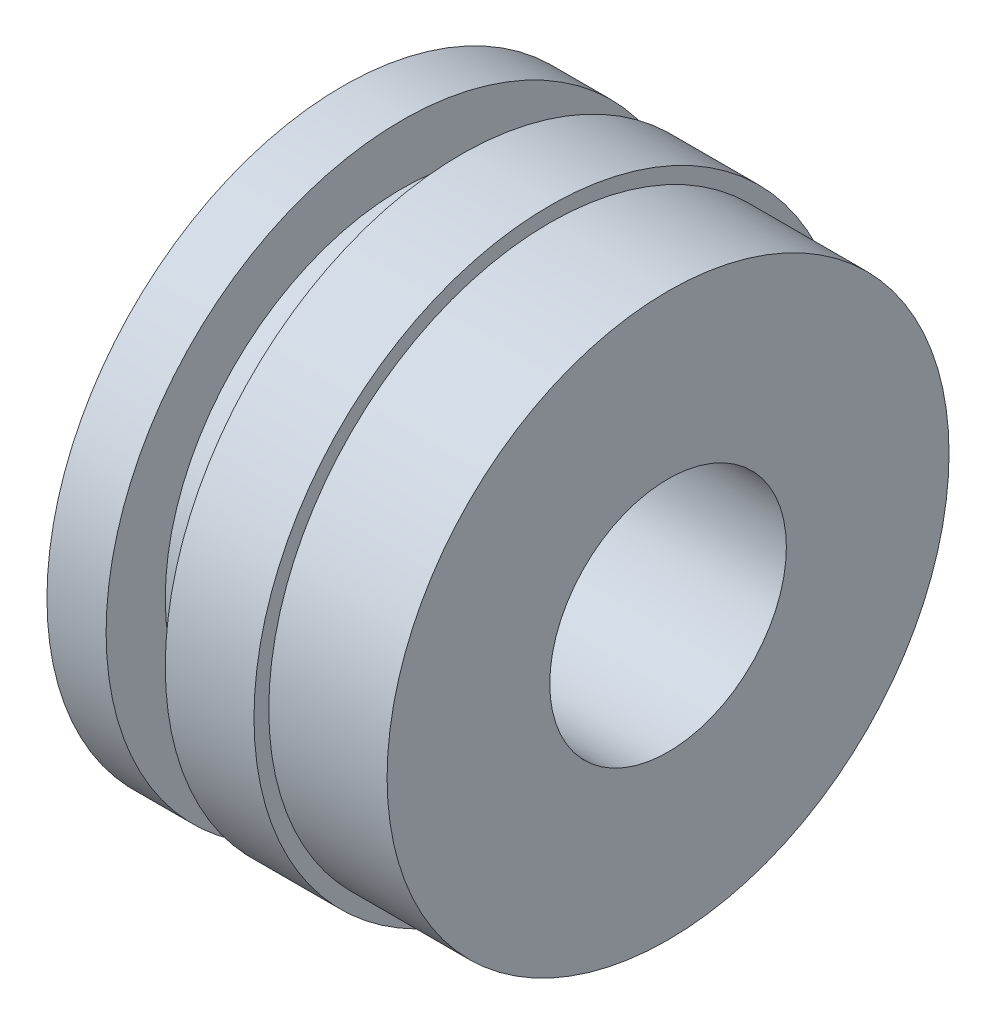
SolidWorks part; units mm, degrees
ref_plane "Plan1" through (0, 0, 0) normal (0, 0, 1) x (1, 0, 0)
ref_plane "Plan2" through (0, 0, 0) normal (0, 1, 0) x (1, 0, 0)
ref_plane "Plan3" through (0, 0, 0) normal (1, 0, 0) x (0, 0, -1)
sketch "Esquisse1" plane through (0, 0, 0) normal (0, 0, 1) x (1, 0, 0)
  line L0 (-25, 0) -> (44, 0) construction
  line L1 (0, 4) -> (11, 4)
  line L2 (0, 4) -> (0, 10)
  line L3 (0, 10) -> (2, 10)
  line L4 (2, 10) -> (2, 8)
  line L5 (2, 8) -> (4, 8)
  line L6 (4, 8) -> (4, 10)
  line L7 (4, 10) -> (7, 10)
  line L8 (7, 10) -> (7, 9.5)
  line L9 (7, 9.5) -> (11, 9.5)
  line L10 (11, 9.5) -> (11, 4)
  dimension "D1" = 10
  dimension "D2" = 4
  dimension "D3" = 0.5
  dimension "D4" = 2
  dimension "D5" = 2
  dimension "D6" = 2
  dimension "D7" = 11
revolve "Base-Révolution" add sketch "Esquisse1" angle 360 about L0
